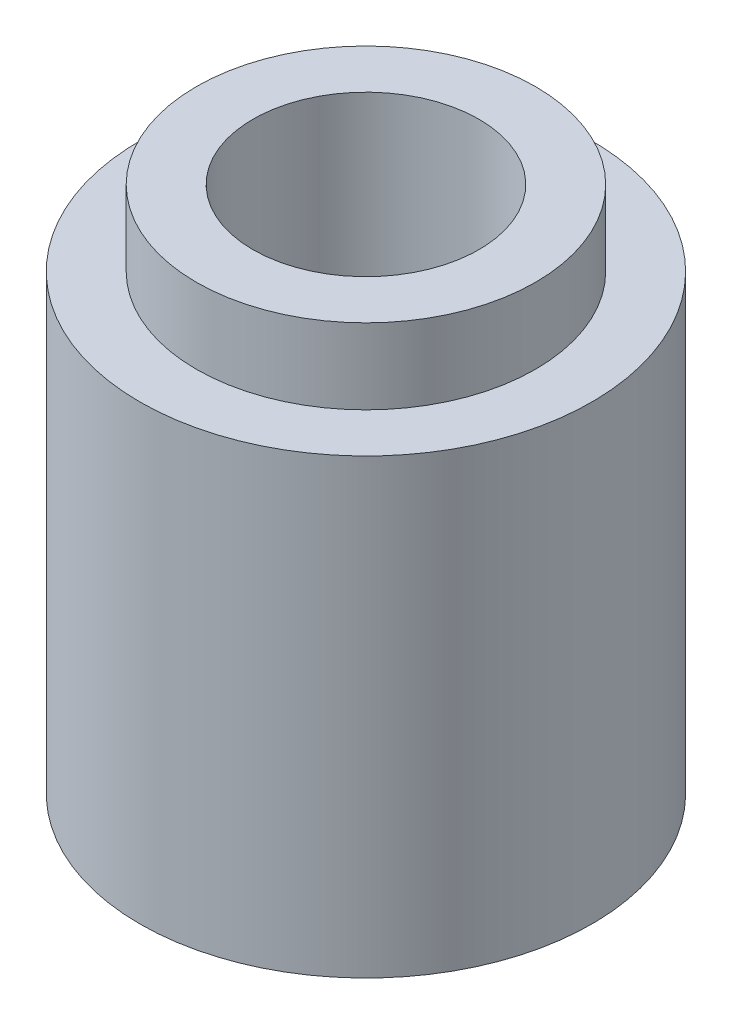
SolidWorks part; units mm, degrees
ref_plane "Спереди" through (0, 0, 0) normal (0, 0, 1) x (1, 0, 0)
ref_plane "Сверху" through (0, 0, 0) normal (0, 1, 0) x (1, 0, 0)
ref_plane "Справа" through (0, 0, 0) normal (1, 0, 0) x (0, 0, -1)
sketch "Эскиз1" plane through (0, 0, 0) normal (0, 1, 0) x (1, 0, 0)
  circle A0 centre (0, 0) radius 3
extrude "Бобышка-Вытянуть1" add sketch "Эскиз1" along normal blind 6
sketch "Эскиз2" plane through (0, 6, 0) normal (0, 1, 0) x (1, 0, 0)
  circle A0 centre (0, 0) radius 2.25
extrude "Бобышка-Вытянуть2" add sketch "Эскиз2" along normal blind 1
sketch "Эскиз3" plane through (0, 0, 0) normal (0, -1, 0) x (1, 0, 0)
  circle A0 centre (0, 0) radius 1.5
extrude "Вырез-Вытянуть1" cut sketch "Эскиз3" against normal up to surface (7 mm away)
